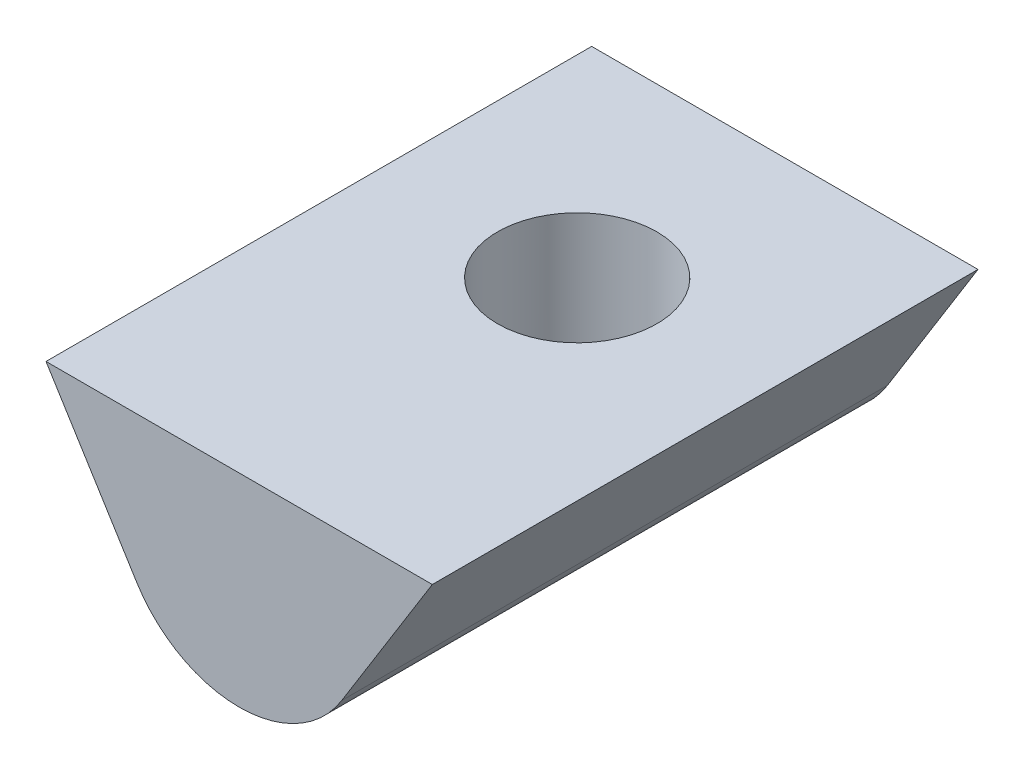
SolidWorks part; units mm, degrees
ref_plane "Ebene vorne" through (0, 0, 0) normal (0, 0, 1) x (1, 0, 0)
ref_plane "Ebene oben" through (0, 0, 0) normal (0, 1, 0) x (1, 0, 0)
ref_plane "Ebene rechts" through (0, 0, 0) normal (1, 0, 0) x (0, 0, -1)
sketch "Skizze1" plane through (0, 0, 0) normal (0, 0, 1) x (1, 0, 0)
  line L0 (0, 0) -> (8, 0)
  line L1 (8, 0) -> (6.1233, -3.0196)
  line L2 (0, 0) -> (1.8767, -3.0196)
  arc A0 (6.1233, -3.0196) -> (1.8767, -3.0196) centre (4, -1.7) cw
  dimension "D1" = 2.5
  dimension "D4" = 4.2
  dimension "D2" = 8
  dimension "D3" = 4
extrude "Linear austragen1" add sketch "Skizze1" along normal blind 11.3
hole_wizard "M4x0.7 Gewindekernloch1" positions "Skizze3" profile "Skizze2" tap size "M4x0.7" standard "DIN"
sketch "Skizze3" plane through (0, 0, 0) normal (0, 1, 0) x (-1, 0, 0)
  line L0 (0, 11.3) -> (0, 0) construction
  line L1 (-8, 0) -> (0, 0) construction
  point P0 (-4, 4.3)
  dimension "D1" = 4
  dimension "D2" = 4.3
sketch "Skizze2" plane through (4, 0, 4.3) normal (1, 0, 0) x (0, 0, 1)
  line L0 (0, 0) -> (0, 4.2)
  line L1 (0, 4.2) -> (1.65, 4.2)
  line L2 (1.65, 4.2) -> (1.65, 0)
  line L5 (1.65, 0) -> (0, 0)
  line L11 (0, -6.35) -> (0, 107.95) construction
  dimension "Bohrerdurchmesser" = 3.3
  dimension "Bohrungstiefe" = 4.2
ref_plane "Ebene1" through (4, 0, 0) normal (1, 0, 0) x (0, 0, -1)
ref_plane "Ebene2" through (0, 0, 4.3) normal (0, 0, 1) x (1, 0, 0)
other "Einfrieren***"
